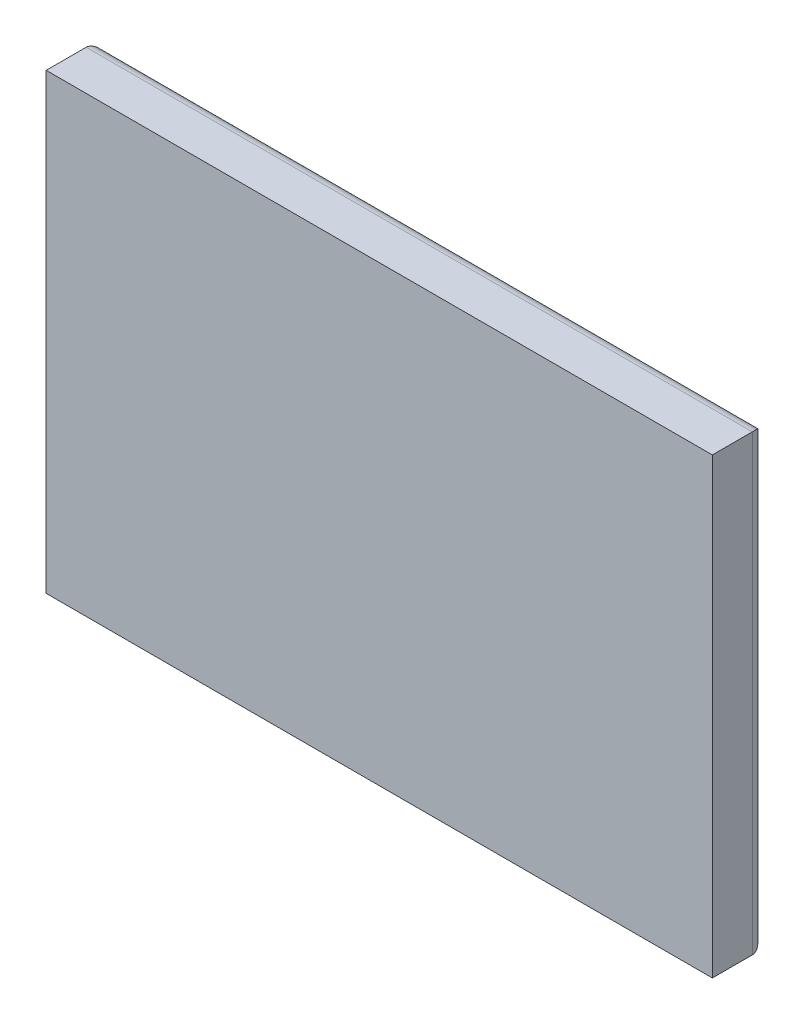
SolidWorks part; units mm, degrees
ref_plane "Front Plane" through (0, 0, 0) normal (0, 0, 1) x (1, 0, 0)
ref_plane "Top Plane" through (0, 0, 0) normal (0, 1, 0) x (1, 0, 0)
ref_plane "Right Plane" through (0, 0, 0) normal (1, 0, 0) x (0, 0, -1)
sketch "Sketch1" plane through (0, 0, 0) normal (0, 0, 1) x (1, 0, 0)
  line L1 (-15.875, -10.795) -> (15.875, -10.795)
  line L2 (-15.875, -10.795) -> (-15.875, 10.795)
  line L3 (-15.875, 10.795) -> (15.875, 10.795)
  line L4 (15.875, -10.795) -> (15.875, 10.795)
  line L5 (-15.875, -10.795) -> (15.875, 10.795) construction
  line L6 (-15.875, 10.795) -> (15.875, -10.795) construction
  point P0 (0, 0)
  dimension "D1" = 31.75
  dimension "D2" = 21.59
extrude "Boss-Extrude1" add sketch "Sketch1" along normal blind 2.54
fillet "Fillet1" radius 0.635 4 edges at (-15.875, 0, 0) (0, -10.795, 0) (0, 10.795, 0) (15.875, 0, 0)
sketch "Sketch2" plane through (0, 0, 2.54) normal (0, 0, 1) x (1, 0, 0)
  line L0 (-15.875, 10.795) -> (-14.977, 9.897) construction
  line L1 (-14.977, 9.897) -> (-14.977, 6.598) construction
  line L2 (-14.977, 6.598) -> (-14.977, 3.299) construction
  line L3 (-14.977, 3.299) -> (-14.977, 0) construction
  line L4 (-14.977, 0) -> (-14.977, -3.299) construction
  line L5 (-14.977, -3.299) -> (-14.977, -6.598) construction
  line L6 (-14.977, -6.598) -> (-14.977, -9.897) construction
  line L7 (-14.977, -9.897) -> (-15.875, -10.795) construction
  line L8 (15.875, 10.795) -> (-15.875, 10.795) construction
  line L9 (-15.875, -10.795) -> (15.875, -10.795) construction
  line L10 (-14.977, -9.897) -> (14.977, -9.897) construction
  line L11 (14.977, -9.897) -> (15.875, -10.795) construction
  line L12 (14.977, -9.897) -> (14.977, -6.598) construction
  line L13 (14.977, -6.598) -> (14.977, -3.299) construction
  line L14 (14.977, -3.299) -> (14.977, 0) construction
  line L15 (14.977, 0) -> (14.977, 3.299) construction
  line L16 (14.977, 3.299) -> (14.977, 6.598) construction
  line L17 (14.977, 6.598) -> (14.977, 9.897) construction
  line L18 (14.977, 9.897) -> (15.875, 10.795) construction
  line L19 (-14.977, 9.897) -> (14.977, 9.897) construction
  line L20 (-14.977, 6.598) -> (14.977, 6.598) construction
  line L21 (-14.977, 3.299) -> (14.977, 3.299) construction
  line L22 (-14.977, 0) -> (14.977, 0) construction
  line L23 (-14.977, -3.299) -> (14.977, -3.299) construction
  line L24 (-14.977, -6.598) -> (14.977, -6.598) construction
  dimension "D1" = 45
  dimension "D2" = 45
  dimension "D3" = 1.27
sketch "Sketch3" plane through (0, 0, 0) normal (0, 0, -1) x (-1, 0, 0)
  line L1 (-14.605, -9.525) -> (14.605, -9.525)
  line L2 (-14.605, -9.525) -> (-14.605, 9.525)
  line L3 (-14.605, 9.525) -> (14.605, 9.525)
  line L4 (14.605, -9.525) -> (14.605, 9.525)
  line L5 (-14.605, -9.525) -> (14.605, 9.525) construction
  line L6 (-14.605, 9.525) -> (14.605, -9.525) construction
  point P0 (0, 0)
  dimension "D1" = 29.21
  dimension "D2" = 19.05
extrude "Cut-Extrude1" cut sketch "Sketch3" against normal blind 1.905
